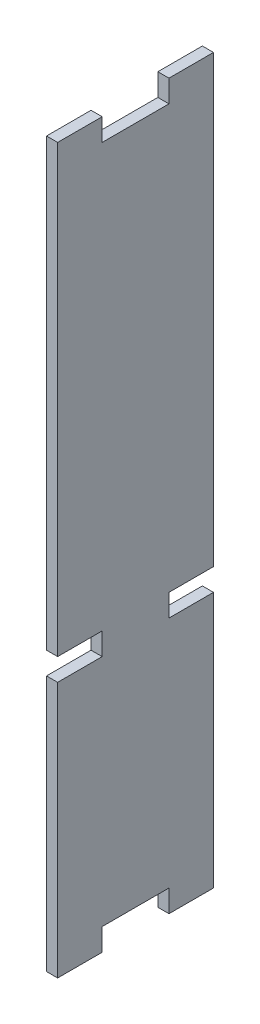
SolidWorks part; units mm, degrees
ref_plane "Front" through (0, 0, 0) normal (0, 0, 1) x (1, 0, 0)
ref_plane "Top" through (0, 0, 0) normal (0, 1, 0) x (1, 0, 0)
ref_plane "Right" through (0, 0, 0) normal (1, 0, 0) x (0, 0, -1)
sketch "Sketch1" plane through (0, 0, 0) normal (1, 0, 0) x (0, 0, -1)
  line L0 (-9.525, 0) -> (9.525, 0)
  line L1 (-9.525, 0) -> (-9.525, -6.35)
  line L2 (-9.525, -6.35) -> (-22.225, -6.35)
  line L3 (-22.225, -6.35) -> (-22.225, 66.675)
  line L4 (-22.225, 66.675) -> (-9.525, 66.675)
  line L5 (-9.525, 66.675) -> (-9.525, 73.025)
  line L6 (-9.525, 73.025) -> (-22.225, 73.025)
  line L7 (-22.225, 73.025) -> (-22.225, 200.025)
  line L8 (-22.225, 200.025) -> (-9.525, 200.025)
  line L9 (0, -1000) -> (0, 49000) construction
  line L10 (9.525, 200.025) -> (9.525, 193.675)
  line L11 (22.225, 200.025) -> (9.525, 200.025)
  line L12 (22.225, 73.025) -> (22.225, 200.025)
  line L13 (-9.525, 200.025) -> (-9.525, 193.675)
  line L14 (-9.525, 193.675) -> (9.525, 193.675)
  line L15 (9.525, 73.025) -> (22.225, 73.025)
  line L16 (9.525, 66.675) -> (9.525, 73.025)
  line L17 (22.225, 66.675) -> (9.525, 66.675)
  line L18 (22.225, -6.35) -> (22.225, 66.675)
  line L19 (9.525, -6.35) -> (22.225, -6.35)
  line L20 (9.525, 0) -> (9.525, -6.35)
  dimension "D1" = 6.35
  dimension "D2" = 12.7
  dimension "D3" = 66.675
  dimension "D4" = 120.65
  dimension "D5" = 19.05
extrude "Extrude1" add sketch "Sketch1" along normal blind 3.175
